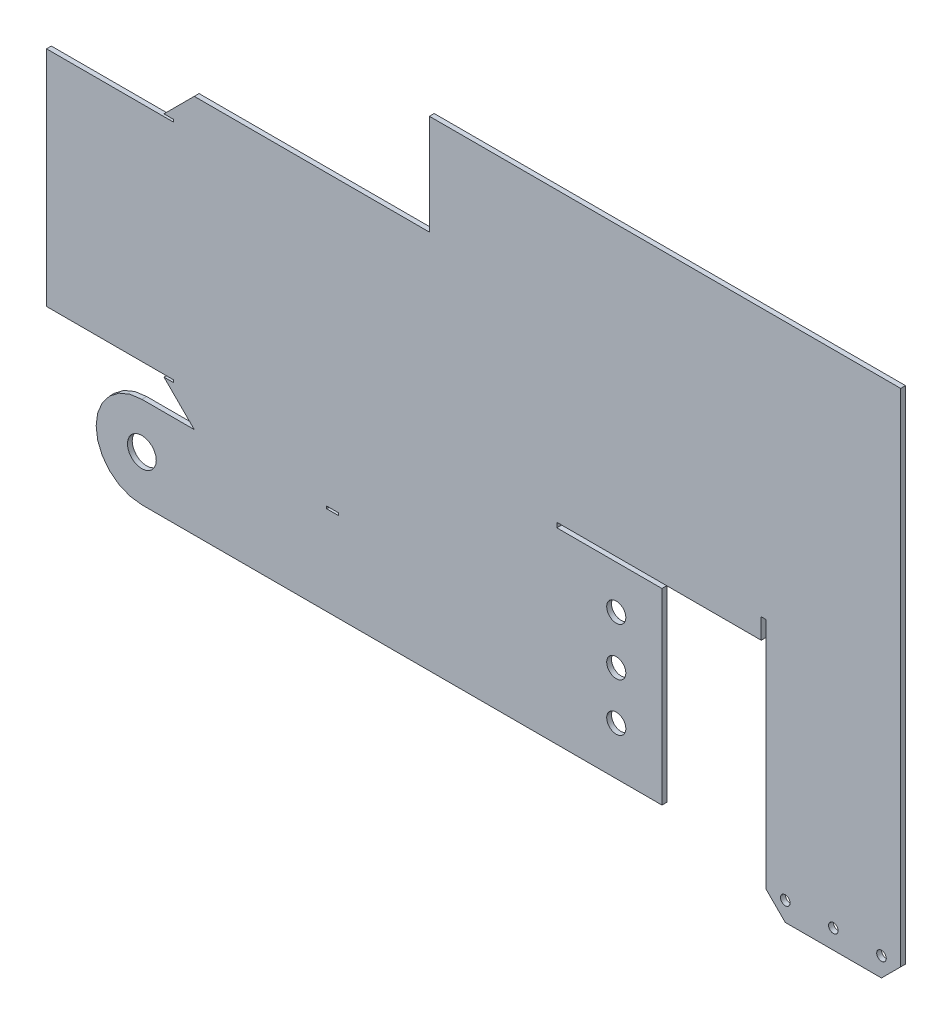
SolidWorks part; units mm, degrees
ref_plane "Plane1" through (0, 0, 0) normal (0, 0, 1) x (1, 0, 0)
ref_plane "Plane2" through (0, 0, 0) normal (0, 1, 0) x (1, 0, 0)
ref_plane "Plane3" through (0, 0, 0) normal (1, 0, 0) x (0, 0, -1)
imported_body "Imported1"
sheet metal parameters "Sheet-Metal1" parameters "D1"=5
bend "RoundBend1" bend radius 2.5 bend angle 90 parameters "D5"=1
flatten bends "Flatten-Bends1" parameters "D1"=0
sketch "Sharp-Sketch1" plane through (0, 0, 2.5) normal (0, 0, 1) x (1, 0, 0)
  line L0 (-49.5548, -100) -> (-49.5548, -2.5) construction
  line L1 (-122.9452, 97.5) -> (-122.9452, -100) construction
  line L2 (55, 4.9019) -> (125, 4.9019) construction
  line L3 (-198.2992, -100) -> (-198.2992, -52.5) construction
  line L4 (125, -68.8602) -> (55, -68.8602) construction
bend "RoundBend2" bend radius 2.5 bend angle 90 parameters "D5"=2
bend "RoundBend3" bend radius 10 bend angle 45 parameters "D5"=3
bend "RoundBend4" bend radius 5 bend angle 90 parameters "D5"=4
bend "RoundBend5" bend radius 10 bend angle 45 parameters "D5"=5
process bends "Process-Bends1" parameters "D1"=0
sketch "Flat-Sketch1" plane through (0, 0, 2.5) normal (0, 0, 1) x (1, 0, 0)
  line L0 (150, -90) -> (20, -90)
bend "FlatBend1" bend radius 5 bend angle 90 parameters "D5"=6
hem "Hem1" parameters "D1"=5, "D7"=40, "D8"=10, "D9"=0.1
bend "HemBend1" bend radius 5 bend angle 180 parameters "D5"=6
edge flange "Edge-Flange1" sketch "Sketch7" bend radius 5 parameters "D6"=10
sketch "Sketch7" plane through (-125, 0, 52.5) normal (0, 0, 1) x (0, 1, 0)
  line L0 (97.5, 0) -> (-52.5, 0) construction
  line L1 (97.5, 0) -> (-52.5, 0)
  line L2 (-52.5, 0) -> (-52.5, 86)
  line L3 (-52.5, 86) -> (97.5, 86)
  line L4 (97.5, 86) -> (97.5, 0)
bend "EdgeBend1" bend radius 5 bend angle 90 parameters "D5"=7
break corner "Break-Corner1" parameters "D1"=2000
edge flange "Edge-Flange2" sketch "Sketch14" bend radius 5 parameters "D6"=10
sketch "Sketch14" plane through (-211, 0, 52.5) normal (1, 0, 0) x (0, -1, 0)
  line L2 (-80.5, 0) -> (-80.5, 60)
  line L3 (-80.5, 60) -> (35.5, 60)
  line L4 (35.5, 60) -> (35.5, 0)
  line L6 (35.5, 0) -> (-80.5, 0) construction
  line L7 (35.5, 0) -> (-80.5, 0)
bend "EdgeBend2" bend radius 5 bend angle 90 parameters "D5"=8
flat pattern "Flat-Pattern1"
sketch "Bend-Lines1" plane through (0, 0, 2.5) normal (0, 0, 1) x (1, 0, 0)
  line L0 (-173.2992, -52.5) -> (-173.2992, 97.5) construction
  line L1 (-120, 107.3175) -> (125, 107.3175) construction
  line L2 (55, -90) -> (125, -90) construction
  line L3 (55, -68.8602) -> (125, -68.8602) construction
  line L4 (-198.2992, -52.5) -> (-198.2992, -100) construction
  line L5 (125, 4.9019) -> (55, 4.9019) construction
  line L6 (-122.9452, -100) -> (-122.9452, 97.5) construction
  line L7 (-49.5548, -2.5) -> (-49.5548, -100) construction
  line L8 (-259.1167, -35.5) -> (-259.1167, 80.5) construction
  line L9 (-259.1167, -35.5) -> (-259.1167, 80.5) construction
  line L10 (-173.2992, -52.5) -> (-173.2992, 97.5) construction
  line L11 (-120, 107.3175) -> (125, 107.3175) construction
  line L12 (55, -90) -> (125, -90) construction
  line L13 (55, -68.8602) -> (125, -68.8602) construction
  line L14 (-198.2992, -52.5) -> (-198.2992, -100) construction
  line L15 (125, 4.9019) -> (55, 4.9019) construction
  line L16 (-122.9452, -100) -> (-122.9452, 97.5) construction
  line L17 (-49.5548, -2.5) -> (-49.5548, -100) construction
sketch3d "Bounding-Box1"
  line L0 (-320.2754, -119.5281, 0) -> (123.75, -119.5281, 0) construction
  line L1 (-320.2754, 150.885, 0) -> (123.75, 150.885, 0) construction
  line L2 (-320.2754, -119.5281, 0) -> (-320.2754, 150.885, 0) construction
  line L3 (123.75, -119.5281, 0) -> (123.75, 150.885, 0) construction
bend of the flat pattern "Flatten-<RoundBend1>1"
bend of the flat pattern "Flatten-<RoundBend2>1"
bend of the flat pattern "Flatten-<RoundBend3>1"
bend of the flat pattern "Flatten-<RoundBend4>1"
bend of the flat pattern "Flatten-<RoundBend5>1"
bend of the flat pattern "Flatten-<HemBend1>1"
bend of the flat pattern "Flatten-<EdgeBend1>1"
bend of the flat pattern "Flatten-<FlatBend1>1"
bend of the flat pattern "Flatten-<EdgeBend2>1"
